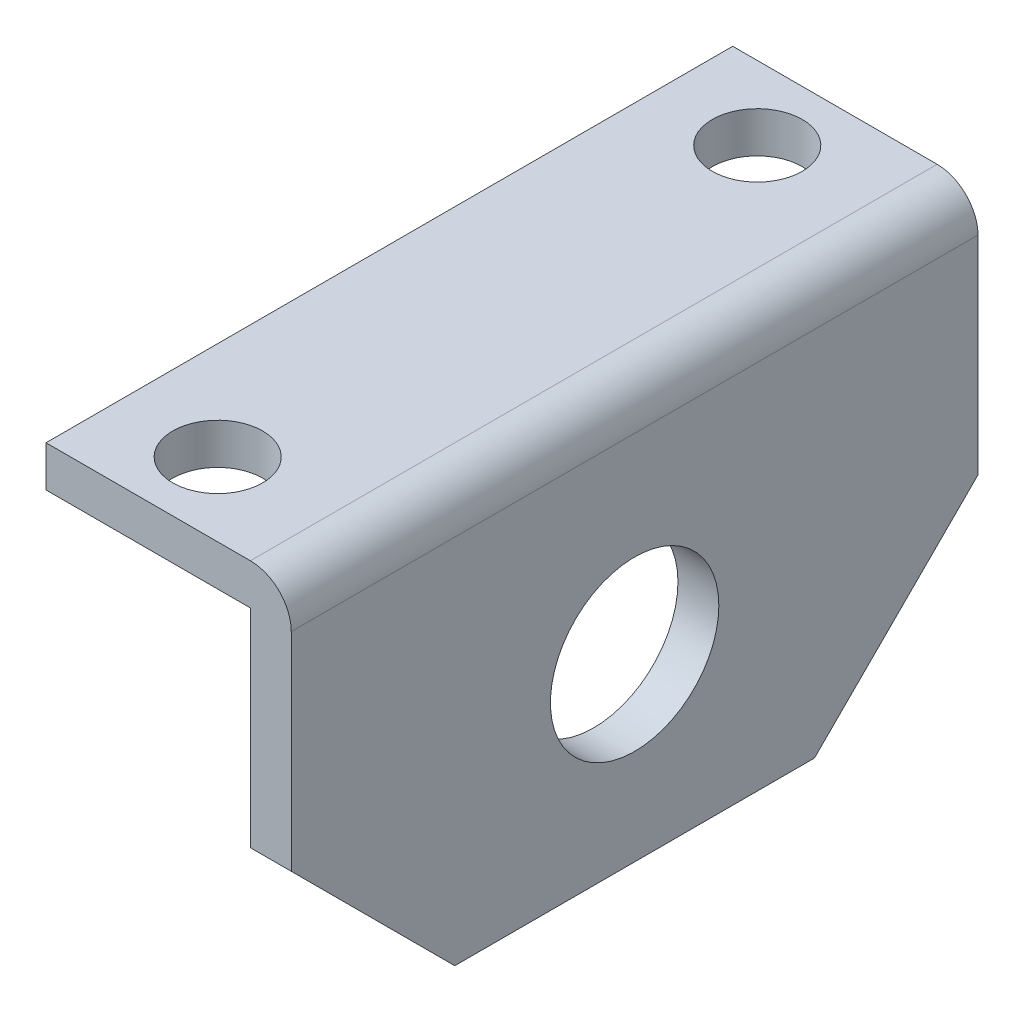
SolidWorks part; units mm, degrees
ref_plane "前视基准面" through (0, 0, 0) normal (0, 0, 1) x (1, 0, 0)
ref_plane "上视基准面" through (0, 0, 0) normal (0, 1, 0) x (1, 0, 0)
ref_plane "右视基准面" through (0, 0, 0) normal (1, 0, 0) x (0, 0, -1)
sketch "草图1" plane through (0, 0, 0) normal (0, 0, 1) x (1, 0, 0)
  line L0 (0, 0) -> (0, -2.5)
  line L1 (0, -2.5) -> (12.5, -2.5)
  line L2 (0, 0) -> (12.5, 0)
  line L3 (12.5, -2.5) -> (12.5, -25.2)
  line L4 (15, -2.5) -> (15, -25.2)
  line L5 (15, -25.2) -> (12.5, -25.2)
  arc A0 (15, -2.5) -> (12.5, 0) centre (12.5, -2.5) ccw
extrude "凸台-拉伸1" add sketch "草图1" along normal blind 42
sketch "草图2" plane through (0, -2.5, 0) normal (0, -1, 0) x (1, 0, 0)
  line L0 (0, 21) -> (12.5, 21) construction
  line L1 (0, 42) -> (0, 0) construction
  line L2 (12.5, 42) -> (12.5, 0) construction
  circle A0 centre (6, 37.5) radius 2.75
  circle A1 centre (6, 4.5) radius 2.75
  dimension "D1" = 33
  dimension "D2" = 6
extrude "切除-拉伸1" cut sketch "草图2" against normal blind 42
sketch "草图3" plane through (15, 0, 0) normal (1, 0, 0) x (0, 0, -1)
  line L0 (-42, -25.2) -> (0, -25.2) construction
  circle A0 centre (-21, -14.2) radius 5.15
  dimension "D1" = 11
extrude "切除-拉伸2" cut sketch "草图3" against normal blind 42
chamfer "倒角1" distance 10 angle 45 2 edges at (13.75, -25.2, 0) (13.75, -25.2, 42)
